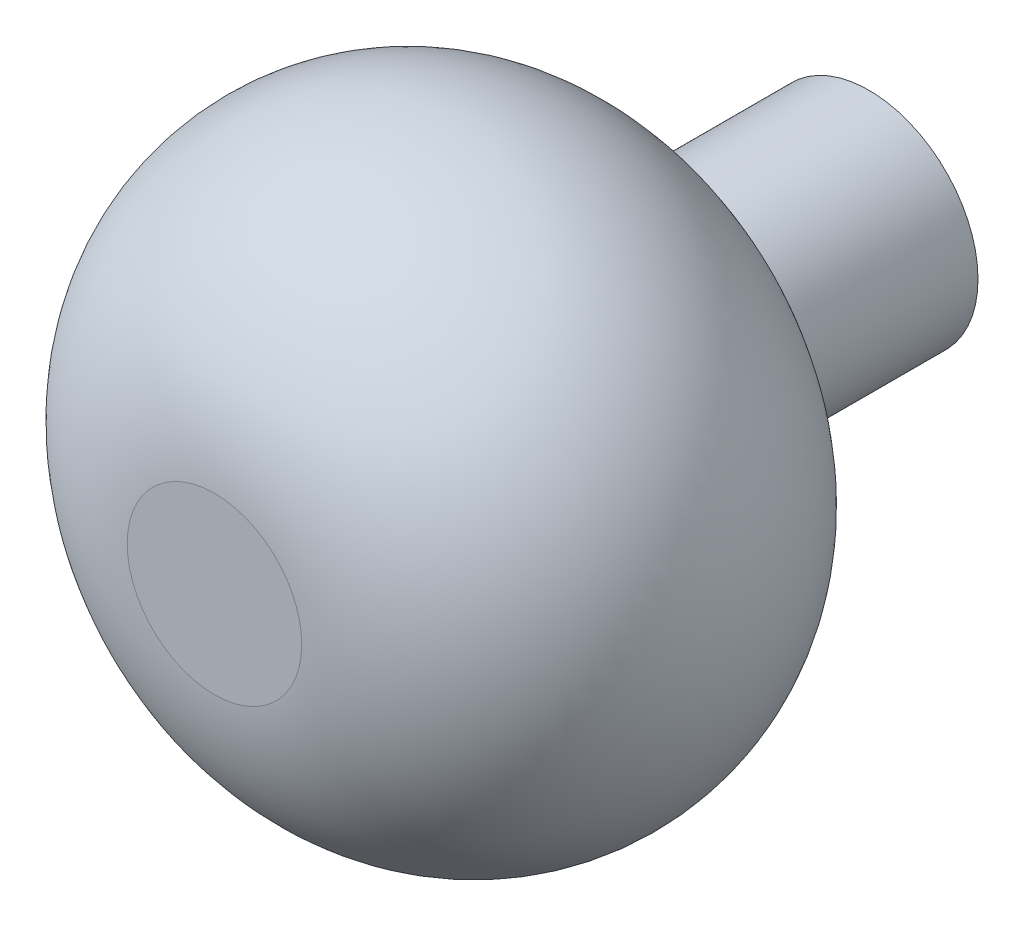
SolidWorks part; units mm, degrees
ref_plane "Front Plane" through (0, 0, 0) normal (0, 0, 1) x (1, 0, 0)
ref_plane "Top Plane" through (0, 0, 0) normal (0, 1, 0) x (1, 0, 0)
ref_plane "Right Plane" through (0, 0, 0) normal (1, 0, 0) x (0, 0, -1)
sketch "Sketch1" plane through (0, 0, 0) normal (1, 0, 0) x (0, 0, -1)
  line L0 (0, 0) -> (-38.1, 0)
  line L1 (-38.1, 0) -> (-38.1, 5.08)
  line L2 (-11.8353, 6.35) -> (0, 6.35)
  line L3 (0, 6.35) -> (0, 0)
  arc A0 (-38.1, 5.08) -> (-11.8353, 6.35) centre (-24.8999, 4.3134) cw
  dimension "D1" = 38.1
revolve "Revolve1" add sketch "Sketch1" angle 360 about L0
